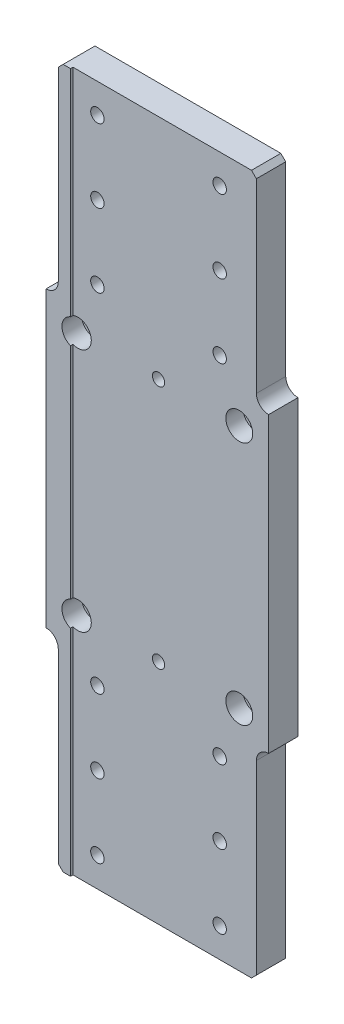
SolidWorks part; units mm, degrees
ref_plane "정면" through (0, 0, 0) normal (0, 0, 1) x (1, 0, 0)
ref_plane "윗면" through (0, 0, 0) normal (0, 1, 0) x (1, 0, 0)
ref_plane "우측면" through (0, 0, 0) normal (1, 0, 0) x (0, 0, -1)
sketch "스케치1" plane through (0, 0, 0) normal (0, 0, 1) x (1, 0, 0)
  line L1 (-45, 60) -> (45, 60)
  line L2 (-45, 60) -> (-45, -60)
  line L3 (-45, -60) -> (45, -60)
  line L4 (45, 60) -> (45, -60)
  line L5 (-40, 143) -> (40, 143)
  line L6 (-40, 143) -> (-40, -143)
  line L7 (-40, -143) -> (40, -143)
  line L8 (40, 143) -> (40, -143)
  line L9 (-40, 143) -> (40, -143) construction
  line L10 (-40, -143) -> (40, 143) construction
  point P4 (0, 0)
  dimension "D1" = 80
  dimension "D2" = 5
  dimension "D3" = 5
  dimension "D4" = 120
  dimension "D5" = 83
  dimension "D6" = 83
extrude "보스-돌출1" add sketch "스케치1" along normal mid plane 13 contours L6 L5 L8 L7 | L2 L1 L4 L3
sketch "스케치2" plane through (0, 0, 6.5) normal (0, 0, 1) x (1, 0, 0)
  line L0 (-40, 143) -> (40, 143) construction
  line L1 (-35, 143) -> (45, 143)
  line L2 (-35, 143) -> (-35, -143)
  line L3 (-35, -143) -> (45, -143)
  line L4 (45, 143) -> (45, -143)
  line L5 (45, 60) -> (45, -60) construction
  line L7 (-40, -143) -> (40, -143) construction
  line L8 (-45, 60) -> (-45, -60) construction
  dimension "D1" = 10
extrude "컷-돌출1" cut sketch "스케치2" against normal blind 1
hole_wizard "M6 소켓 머리 캡 나사용 카운터보어1" positions "스케치3" profile "스케치4" counterbore size "M6" standard "KS"
sketch "스케치3" plane through (0, 0, 6.5) normal (0, 0, 1) x (1, 0, 0)
  line L0 (40, 143) -> (-35, 143) construction
  line L2 (45, -60) -> (45, 60) construction
  point P0 (-33, 50)
  point P2 (33, 50)
  point P4 (-33, -50)
  point P6 (33, -50)
  dimension "D1" = 100
  dimension "D2" = 93
  dimension "D3" = 66
  dimension "D4" = 12
sketch "스케치4" plane through (-33, 50, 6.5) normal (1, 0, 0) x (0, -1, 0)
  line L0 (0, 0) -> (0, 13)
  line L1 (0, 13) -> (3.3, 13)
  line L3 (3.3, 13) -> (3.3, 8)
  line L4 (3.3, 8) -> (5.5, 8)
  line L5 (5.5, 8) -> (5.5, 0)
  line L7 (5.5, 0) -> (0, 0)
  line L11 (0, -6.35) -> (0, 107.95) construction
  dimension "관통 구멍 지름" = 6.6
  dimension "관통 구멍 깊이" = 13
  dimension "카운터보어 지름" = 11
  dimension "카운터보어 깊이" = 8
hole_wizard "M5 소켓 머리 캡 나사용 카운터보어1" positions "스케치5" profile "스케치6" counterbore size "M5" standard "KS"
sketch "스케치5" plane through (0, 0, -6.5) normal (0, 0, -1) x (-1, 0, 0)
  line L0 (-40, 143) -> (-40, 60) construction
  line L3 (40, 143) -> (-40, 143) construction
  point P0 (-25, 131)
  point P2 (25, 131)
  point P4 (-25, 101)
  point P6 (25, 101)
  point P8 (-25, 71)
  point P10 (25, 71)
  dimension "D1" = 50
  dimension "D2" = 15
  dimension "D3" = 12
  dimension "D4" = 30
  dimension "D5" = 30
sketch "스케치6" plane through (25, 131, -6.5) normal (1, 0, 0) x (0, 1, 0)
  line L0 (0, 0) -> (0, 13)
  line L1 (0, 13) -> (2.75, 13)
  line L3 (2.75, 13) -> (2.75, 7)
  line L4 (2.75, 7) -> (4.75, 7)
  line L5 (4.75, 7) -> (4.75, 0)
  line L7 (4.75, 0) -> (0, 0)
  line L11 (0, -6.35) -> (0, 107.95) construction
  dimension "관통 구멍 지름" = 5.5
  dimension "관통 구멍 깊이" = 13
  dimension "카운터보어 지름" = 9.5
  dimension "카운터보어 깊이" = 7
pattern_linear "선형 패턴1" count 2 spacing 202 along (0, -1, 0) of "M5 소켓 머리 캡 나사용 카운터보어1"
hole_wizard "Ø5.0mm 맞춤핀 구멍1" positions "스케치7" profile "스케치8" hole size "Ø5.0" standard "ISO"
sketch "스케치7" plane through (0, 0, 5.5) normal (0, 0, 1) x (1, 0, 0)
  line L0 (0, 0) -> (0, 92.2124) construction
  line L4 (40, 143) -> (-35, 143) construction
  point P0 (0, 50)
  point P2 (0, -50)
  dimension "D1" = 100
  dimension "D2" = 93
sketch "스케치8" plane through (0, 50, 5.5) normal (1, 0, 0) x (0, -1, 0)
  line L0 (0, 0) -> (0, 12)
  line L1 (0, 12) -> (2.5, 12)
  line L2 (2.5, 12) -> (2.5, 0)
  line L5 (2.5, 0) -> (0, 0)
  line L11 (0, -6.35) -> (0, 107.95) construction
  dimension "관통 구멍 지름" = 5
  dimension "관통 구멍 깊이" = 12
fillet "필렛1" radius 5 4 edges at (40, -60, -0.5) (-40, -60, 0) (-40, 60, 0) (40, 60, -0.5)
chamfer "모따기1" distance 2 angle 45 4 edges at (-40, -143, 0) (40, -143, -0.5) (-40, 143, 0) (40, 143, -0.5)
